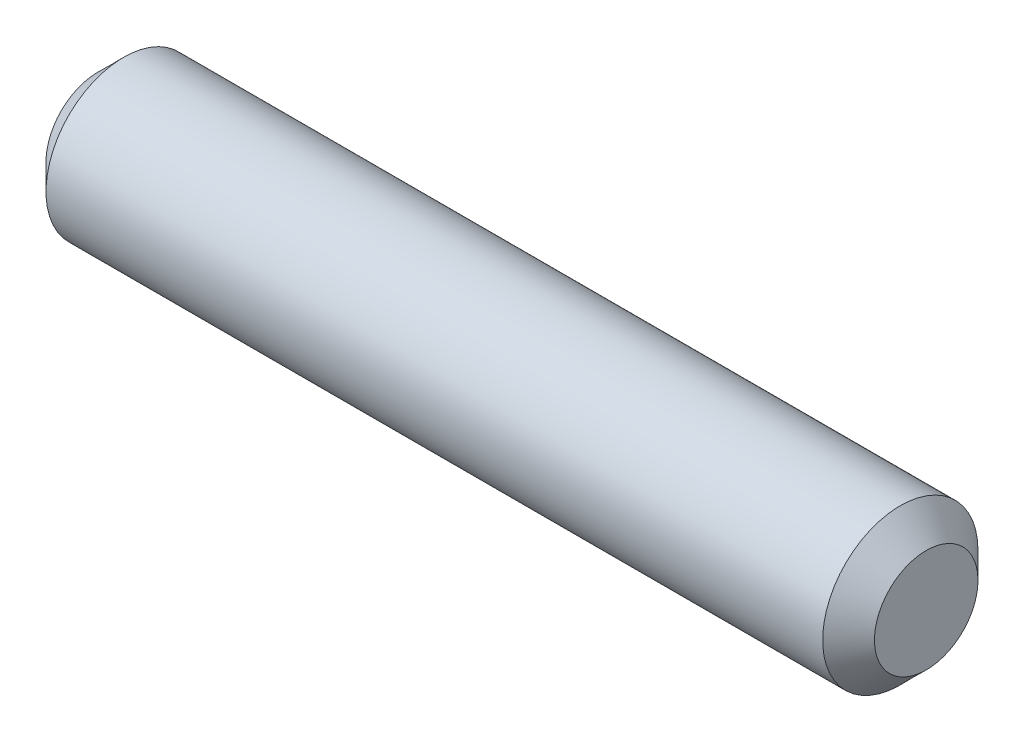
SolidWorks part; units mm, degrees
ref_plane "Спереди" through (0, 0, 0) normal (0, 0, 1) x (1, 0, 0)
ref_plane "Сверху" through (0, 0, 0) normal (0, 1, 0) x (1, 0, 0)
ref_plane "Справа" through (0, 0, 0) normal (1, 0, 0) x (0, 0, -1)
sketch "Эскиз8" plane through (0, 0, 0) normal (1, 0, 0) x (0, 0, -1)
  circle A0 centre (0, 0) radius 1.5
  dimension "D1" = 3
extrude "Бобышка-Вытянуть5" add sketch "Эскиз8" along normal blind 16
chamfer "Фаска2" distance 0.5 angle 45 2 edges at (0, 0, -1.5) (16, 0, -1.5)
ref_plane "Плоскость1" through (8, 0, 0) normal (1, 0, 0) x (0, 0, -1)
